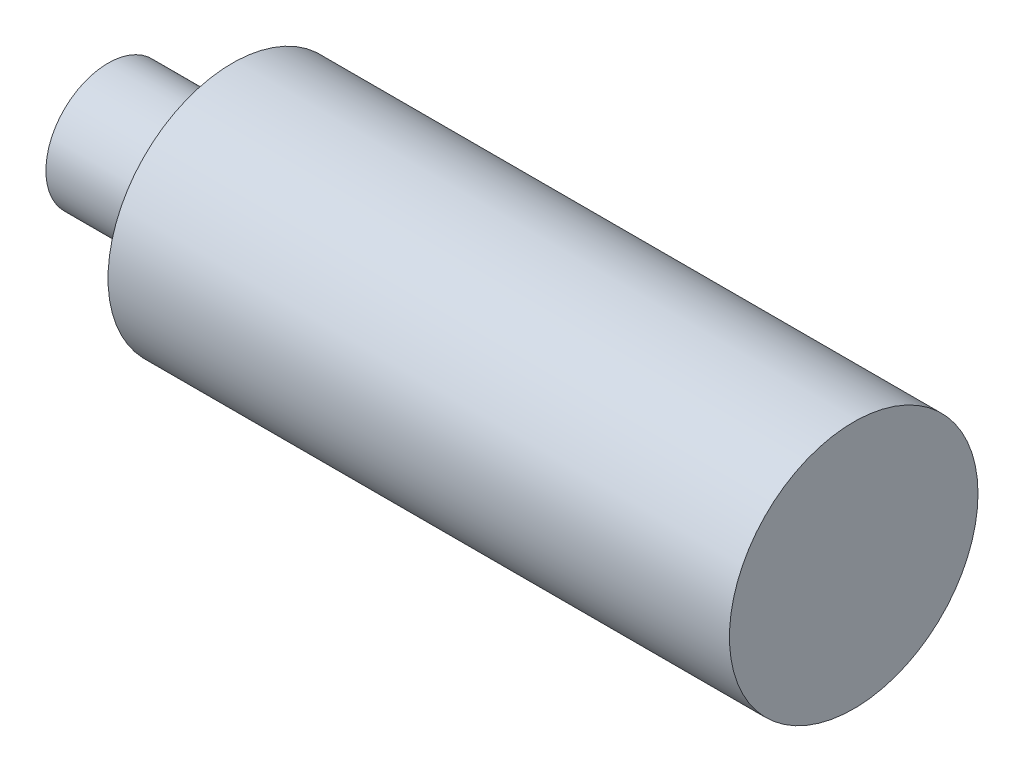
SolidWorks part; units mm, degrees
ref_plane "前视基准面" through (0, 0, 0) normal (0, 0, 1) x (1, 0, 0)
ref_plane "上视基准面" through (0, 0, 0) normal (0, 1, 0) x (1, 0, 0)
ref_plane "右视基准面" through (0, 0, 0) normal (1, 0, 0) x (0, 0, -1)
sketch "草图1" plane through (0, 0, 0) normal (1, 0, 0) x (0, 0, -1)
  circle A0 centre (0, 0) radius 1
  dimension "D1" = 2
extrude "凸台-拉伸1" add sketch "草图1" along normal blind 2
sketch "草图2" plane through (2, 0, 0) normal (1, 0, 0) x (0, 0, -1)
  circle A0 centre (0, 0) radius 2
  dimension "D1" = 4
extrude "凸台-拉伸2" add sketch "草图2" along normal blind 10
